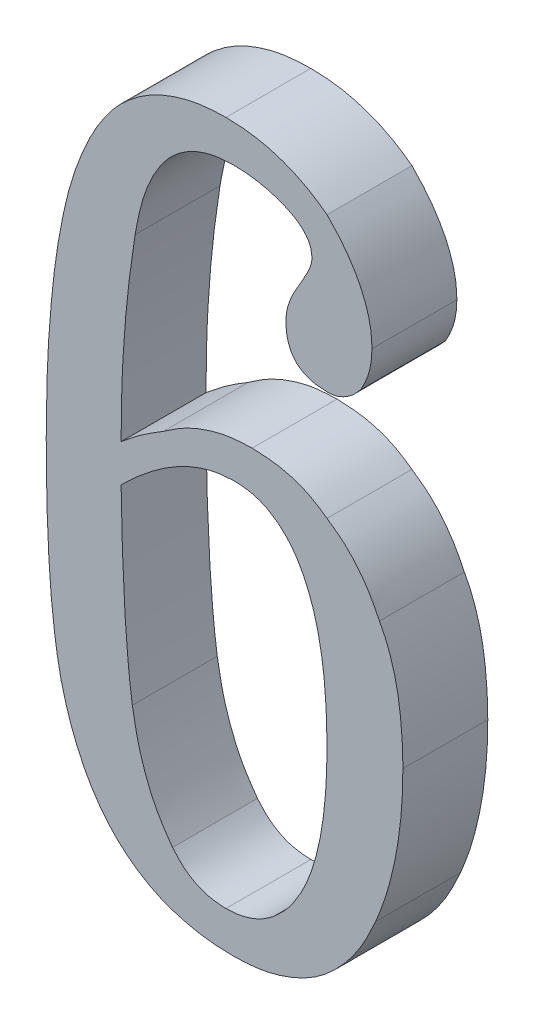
SolidWorks part; units mm, degrees
ref_plane "前基準面" through (0, 0, 0) normal (0, 0, 1) x (1, 0, 0)
ref_plane "上基準面" through (0, 0, 0) normal (0, 1, 0) x (1, 0, 0)
ref_plane "右基準面" through (0, 0, 0) normal (1, 0, 0) x (0, 0, -1)
sketch "草圖1" plane through (0, 0, 0) normal (0, 0, 1) x (1, 0, 0)
  text T0 "6" font "標楷體" height 25
extrude "填料-伸長1" add sketch "草圖1" along normal blind 3
